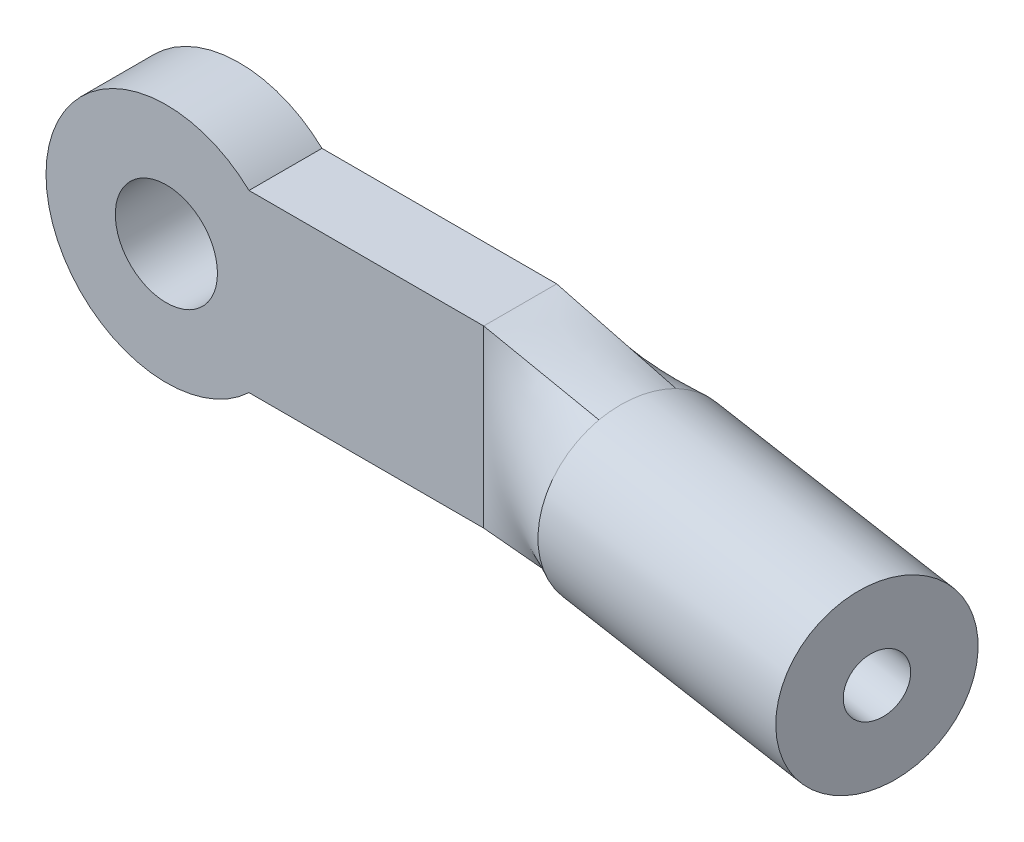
SolidWorks part; units mm, degrees
ref_plane "Face" through (0, 0, 0) normal (0, 0, 1) x (1, 0, 0)
ref_plane "Dessus" through (0, 0, 0) normal (0, 1, 0) x (1, 0, 0)
ref_plane "Droite" through (0, 0, 0) normal (1, 0, 0) x (0, 0, -1)
sketch "Esquisse1" plane through (0, 0, 0) normal (0, 0, 1) x (1, 0, 0)
  line L0 (1.1325, 1.2) -> (4.35, 1.2)
  line L1 (4.35, 1.2) -> (4.35, -1.2)
  line L2 (4.35, -1.2) -> (1.1325, -1.2)
  line L3 (1.1325, 1.2) -> (1.1325, -1.2) construction
  circle A0 centre (0, 0) radius 1.65
  circle A1 centre (0, 0) radius 0.7
  dimension "D1" = 1.4
  dimension "D2" = 3.3
  dimension "D3" = 2.4
  dimension "D4" = 4.35
extrude "Extrusion1" add sketch "Esquisse1" along normal mid plane 1 contours L3 A0 A1 | A0 L3 | A0 L2 L1 L0
sketch "Esquisse4" plane through (0, 0, 0) normal (0, 0, 1) x (1, 0, 0)
  line L0 (4.35, 0) -> (4.1191, 0) construction
  line L1 (4.35, 1.2) -> (4.35, -1.2) construction
  line L2 (4.1191, 0) -> (4.35, 0.4)
  line L3 (4.35, 0.4) -> (4.35, 0)
  line L4 (4.35, 0) -> (4.1191, 0)
  dimension "D1" = 60
  dimension "D2" = 0.4
ref_point "Point2"
ref_plane "Plan2" through (10.1318, 0.2591, 1.7503) normal (-0.9851, -0.0252, -0.1702) x (-0.1699, -0.0119, 0.9854)
sketch "Esquisse5" plane through (10.1318, 0.2591, 1.7503) normal (-0.9851, -0.0252, -0.1702) x (-0.1699, -0.0119, 0.9854)
  circle A0 centre (-0.7392, -0.1168) radius 1.2
  dimension "D1" = 2.4
extrude "Extrusion3" add sketch "Esquisse5" along normal blind 4 separate body
loft "Lissage2" add
sketch "Esquisse6" plane through (10.1318, 0.2591, 1.7503) normal (0.9851, 0.0252, 0.1702) x (0.1701, 0.0044, -0.9854)
  circle A0 centre (0.74, -0.1112) radius 0.4
  dimension "D1" = 0.8
extrude "Extrusion4" cut sketch "Esquisse6" against normal blind 6
